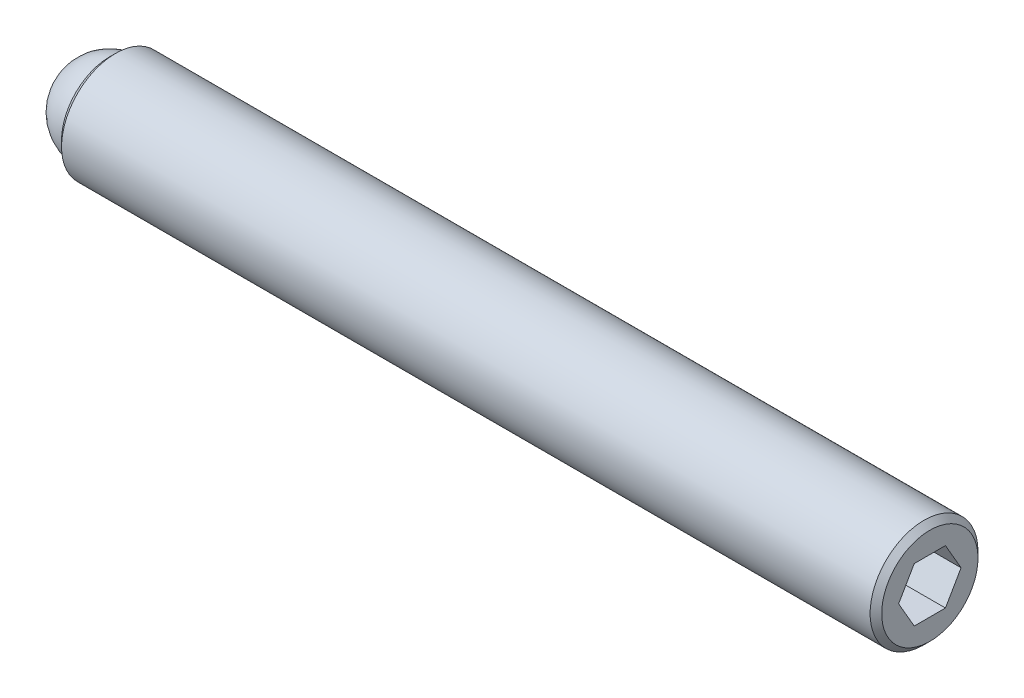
SolidWorks part; units mm, degrees
ref_plane "Front Plane" through (0, 0, 0) normal (0, 0, 1) x (1, 0, 0)
ref_plane "Top Plane" through (0, 0, 0) normal (0, 1, 0) x (1, 0, 0)
ref_plane "Right Plane" through (0, 0, 0) normal (1, 0, 0) x (0, 0, -1)
sketch "Sketch2" plane through (0, 0, 0) normal (1, 0, 0) x (0, 0, -1)
  circle A0 centre (0, 0) radius 2.3749
  dimension "D1" = 4.7498
extrude "Boss-Extrude1" add sketch "Sketch2" along normal blind 36.1156
sketch "Sketch3" plane through (0, 0, 0) normal (-1, 0, 0) x (0, 0, 1)
  circle A0 centre (0, 0) radius 1.9812
  dimension "D1" = 3.9624
chamfer "Chamfer1" distance 0.254 angle 45 1 edges at (0, 0, -2.3749)
chamfer "Chamfer2" distance 0.254 angle 45 1 edges at (36.1156, 0, -2.3749)
sketch "Sketch4" plane through (36.1156, 0, 0) normal (1, 0, 0) x (0, 0, -1)
  line L1 (1.3748, 0) -> (0.6874, 1.1906)
  line L2 (0.6874, 1.1906) -> (-0.6874, 1.1906)
  line L3 (-0.6874, 1.1906) -> (-1.3748, 0)
  line L4 (-1.3748, 0) -> (-0.6874, -1.1906)
  line L5 (-0.6874, -1.1906) -> (0.6874, -1.1906)
  line L6 (0.6874, -1.1906) -> (1.3748, 0)
  circle A0 centre (0, 0) radius 1.1906 construction
  dimension "D1" = 2.3813
extrude "Cut-Extrude2" cut sketch "Sketch4" against normal blind 2.286
extrude "Cut-Extrude3" cut sketch "Sketch3" against normal blind 1.9844
sketch "Sketch5" plane through (0, 0, 0) normal (-1, 0, 0) x (0, 0, 1)
  line L0 (0, 0) -> (0, -1.9844)
  line L1 (0, 0) -> (0, 1.9844)
  arc A0 (0, 1.9844) -> (0, -1.9844) centre (0, 0) ccw
  dimension "D1" = 1.9844
revolve "Revolve1" add sketch "Sketch5" angle 360 about L1
